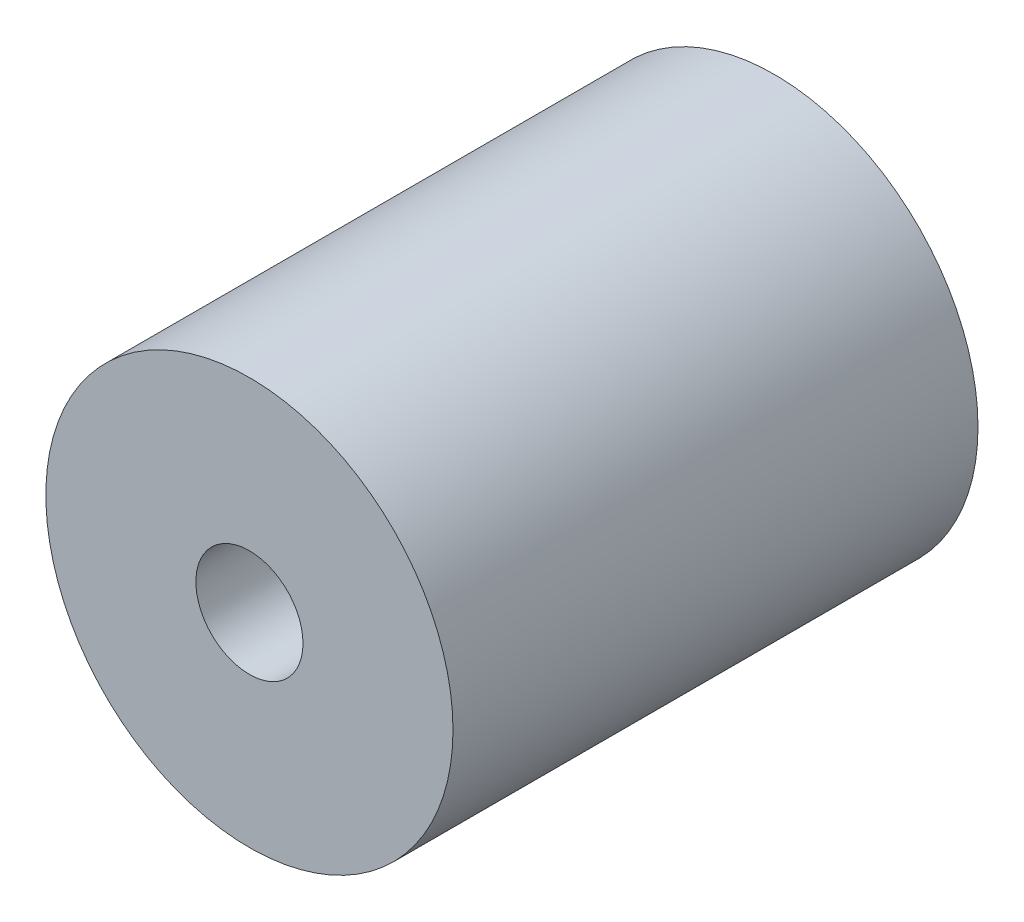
SolidWorks part; units mm, degrees
ref_plane "Ebene vorne" through (0, 0, 0) normal (0, 0, 1) x (1, 0, 0)
ref_plane "Ebene oben" through (0, 0, 0) normal (0, 1, 0) x (1, 0, 0)
ref_plane "Ebene rechts" through (0, 0, 0) normal (1, 0, 0) x (0, 0, -1)
sketch "Skizze1" plane through (0, 0, 0) normal (0, 0, 1) x (1, 0, 0)
  circle A0 centre (0, 0) radius 9.5
  dimension "D1" = 19
extrude "Aufsatz-Linear austragen1" add sketch "Skizze1" along normal blind 24.5
sketch "Skizze2" plane through (0, 0, 24.5) normal (0, 0, 1) x (1, 0, 0)
  circle A0 centre (0, 0) radius 2.5
  dimension "D1" = 5
extrude "Schnitt-Linear austragen1" cut sketch "Skizze2" against normal blind 7
sketch "Skizze3" plane through (0, 0, 0) normal (0, 0, -1) x (-1, 0, 0)
  circle A0 centre (0, 0) radius 2.5
  dimension "D1" = 5
extrude "Schnitt-Linear austragen2" cut sketch "Skizze3" against normal blind 7
